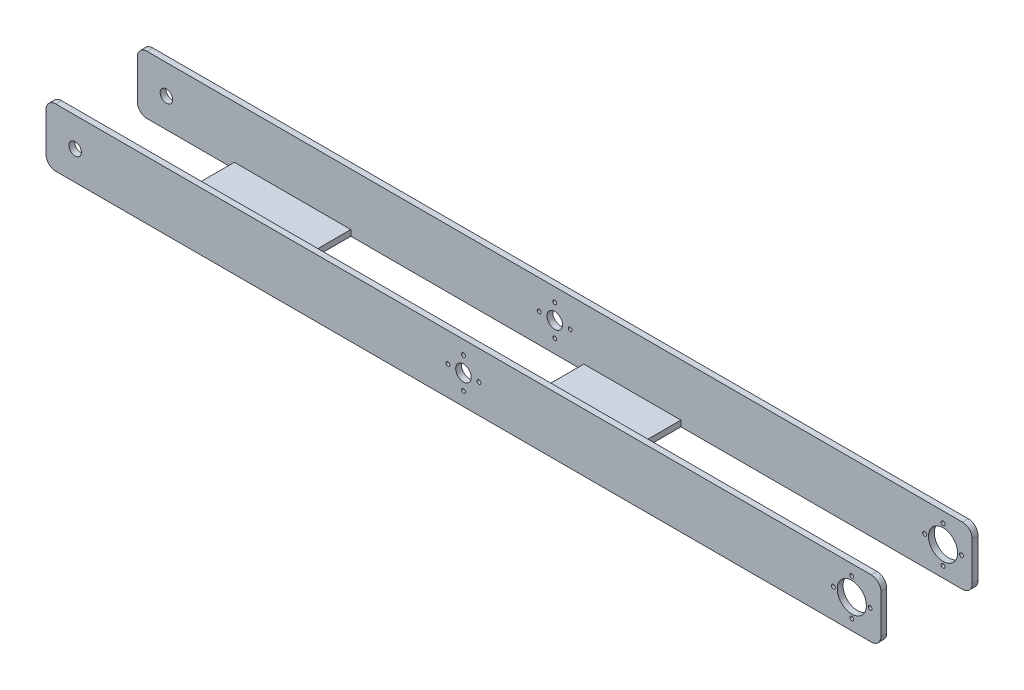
SolidWorks part; units mm, degrees
ref_plane "Front Plane" through (0, 0, 0) normal (0, 0, 1) x (1, 0, 0)
ref_plane "Top Plane" through (0, 0, 0) normal (0, 1, 0) x (1, 0, 0)
ref_plane "Right Plane" through (0, 0, 0) normal (1, 0, 0) x (0, 0, -1)
sketch "Sketch1" plane through (0, 0, 0) normal (0, 0, 1) x (1, 0, 0)
  line L1 (-215, -15) -> (215, -15)
  line L2 (-215, -15) -> (-215, 15)
  line L3 (-215, 15) -> (215, 15)
  line L4 (215, -15) -> (215, 15)
  line L5 (-215, -15) -> (215, 15) construction
  line L6 (-215, 15) -> (215, -15) construction
  point P0 (0, 0)
  dimension "420" = 430
  dimension "D2" = 30
extrude "Boss-Extrude1" add sketch "Sketch1" along normal blind 50
shell "Shell3" thickness 3
sketch "Sketch2" plane through (0, -12, 0) normal (0, 1, 0) x (1, 0, 0)
  line L0 (215, 0) -> (-215, 0) construction
  line L5 (215, -50) -> (-215, -50) construction
  line L6 (215, -50) -> (215, -47) construction
  line L13 (215, -3) -> (65, -3)
  line L14 (215, -3) -> (215, -47)
  line L15 (215, -47) -> (65, -47)
  line L16 (65, -3) -> (65, -47)
  line L25 (-215, -3) -> (-165, -3)
  line L26 (-215, -3) -> (-215, -47)
  line L27 (-165, -3) -> (-165, -47)
  line L28 (-215, -47) -> (-165, -47)
  line L29 (-215, -50) -> (-215, -47) construction
  line L32 (15, -3) -> (-105, -3)
  line L34 (15, -3) -> (15, -47.232)
  line L35 (-105, -3) -> (-105, -47.232)
  line L36 (15, -47.232) -> (-105, -47.232)
  line L37 (215, -3) -> (-215, -3) construction
  dimension "D2" = 3
  dimension "D3" = 3
  dimension "D4" = 50
  dimension "D5" = 320
  dimension "D6" = 150
  dimension "D7" = 200
  dimension "2" = 3
  dimension "D10" = 3
extrude "Cut-Extrude3" cut sketch "Sketch2" against normal up to next
sketch "Sketch3" plane through (0, 0, 0) normal (0, 0, -1) x (-1, 0, 0)
  line L0 (0, 0) -> (0, 15) construction
  line L1 (-215, 15) -> (215, 15) construction
  line L2 (0, 0) -> (0, -15) construction
  line L3 (215, -15) -> (-215, -15) construction
  line L4 (0, 0) -> (215, 0) construction
  line L5 (215, 15) -> (215, -15) construction
  line L6 (0, 0) -> (-215, 0) construction
  line L7 (-215, -15) -> (-215, 15) construction
  circle A0 centre (0, 0) radius 4
  circle A1 centre (0, 8) radius 1
  circle A2 centre (0, -8) radius 1
  circle A3 centre (8, 0) radius 1
  circle A4 centre (-8, 0) radius 1
  circle A5 centre (200, 0) radius 3.2
  circle A6 centre (-200, 0) radius 7.5
  circle A7 centre (-200, 9.5) radius 1
  circle A8 centre (-190.5, 0) radius 1
  circle A9 centre (-200, -9.5) radius 1
  circle A10 centre (-209.5, 0) radius 1
  dimension "D1" = 8
  dimension "D6" = 2
  dimension "D7" = 2
  dimension "D8" = 2
  dimension "D9" = 2
  dimension "D13" = 6.4
  dimension "D15" = 15
  dimension "D11" = 2
  dimension "D12" = 2
  dimension "D19" = 2
  dimension "D20" = 2
  dimension "D2" = 8
  dimension "D3" = 8
  dimension "D4" = 9.5
  dimension "D5" = 9.5
  dimension "D10" = 200
  dimension "D14" = 200
  dimension "D16" = 15
  dimension "D17" = 9.5
  dimension "D18" = 9.5
  dimension "D21" = 15
extrude "Cut-Extrude2" cut sketch "Sketch3" against normal through all
fillet "Fillet1" radius 5 8 edges at (-215, -15, 1.5) (-215, 15, 1.5) (-215, -15, 48.5) (-215, 15, 48.5) (215, -15, 48.5) (215, -15, 1.5) (215, 15, 1.5) (215, 15, 48.5)
